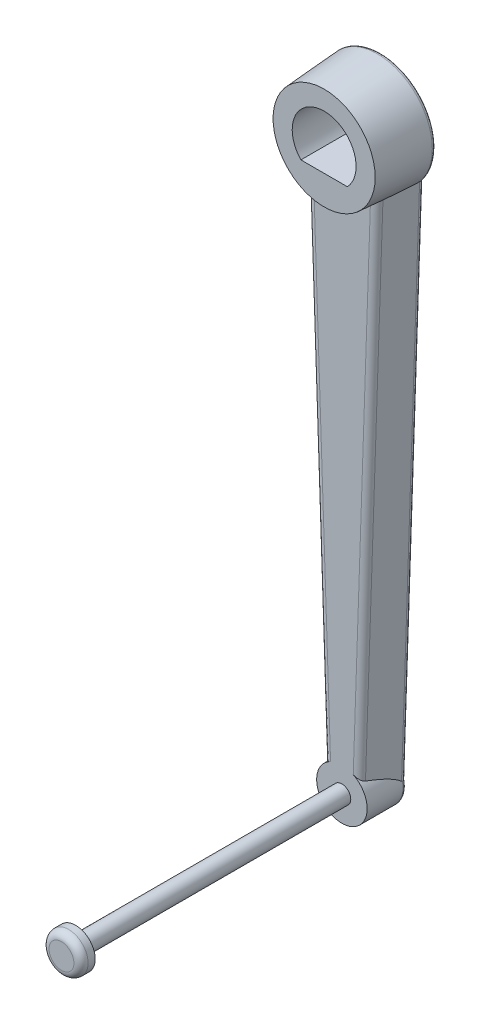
SolidWorks part; units mm, degrees
ref_plane "Plane1" through (0, 0, 0) normal (0, 0, 1) x (1, 0, 0)
ref_plane "Plane2" through (0, 0, 0) normal (0, 1, 0) x (1, 0, 0)
ref_plane "Plane3" through (0, 0, 0) normal (1, 0, 0) x (0, 0, -1)
sketch "Sketch1" plane through (0, 0, 0) normal (0, 0, 1) x (1, 0, 0)
  circle A0 centre (0, 0) radius 15.5
  dimension "D1" = 31
extrude "Base-Extrude" add sketch "Sketch1" along normal blind 16 draft 4
sketch "Sketch2" plane through (0, 0, 0) normal (0, 0, -1) x (-1, 0, 0)
  line L0 (0, 0) -> (0, -179.0103) construction
  line L1 (12.4083, -4.9633) -> (7.1192, -160)
  line L2 (-12.4083, -4.9633) -> (-7.1192, -160)
  line L3 (-7.1192, -160) -> (7.1192, -160)
  line L4 (-12.4083, -4.9633) -> (12.4083, -4.9633)
extrude "Boss-Extrude1" add sketch "Sketch2" against normal blind 11 draft 13
sketch "Sketch3" plane through (0, 0, 11) normal (0, 0, 1) x (1, 0, 0)
  line L0 (0, 0) -> (0, -165.9361) construction
  circle A0 centre (0, -160.1497) radius 7.1141
extrude "Boss-Extrude2" add sketch "Sketch3" against normal blind 11
sketch "Sketch4" plane through (0, 0, 11) normal (0, 0, 1) x (1, 0, 0)
  circle A0 centre (0, -160.1497) radius 2.5
  dimension "D1" = 5
extrude "Boss-Extrude3" add sketch "Sketch4" along normal blind 75
sketch "Sketch5" plane through (0, 0, 86) normal (0, 0, 1) x (1, 0, 0)
  circle A0 centre (0, -160.1497) radius 5.5
  dimension "D1" = 11
extrude "Boss-Extrude4" add sketch "Sketch5" along normal blind 4
fillet "Fillet1" radius 2
sketch "Sketch6" plane through (0, 0, 16) normal (0, 0, 1) x (1, 0, 0)
  line L0 (-6.5518, -6.1704) -> (6.5518, -6.1704)
  arc A0 (6.5518, -6.1704) -> (-6.5518, -6.1704) centre (0, 0) ccw
  dimension "D1" = 18
extrude "Cut-Extrude2" cut sketch "Sketch6" against normal through all
sketch "Sketch7" plane through (0, 0, 0) normal (0, 0, -1) x (-1, 0, 0)
  line L0 (-6.6236, -9.0555) -> (6.6236, -9.0555)
  line L1 (9.6218, -12.1578) -> (4.7866, -153.891)
  line L2 (1.7883, -156.7887) -> (-1.7883, -156.7887)
  line L3 (-4.7866, -153.891) -> (-9.6218, -12.1578)
  line L4 (12.2538, -9.4918) -> (7.1192, -160) construction
  line L5 (-12.2538, -9.4918) -> (-7.1192, -160) construction
  arc A0 (1.7883, -156.7887) -> (4.7866, -153.891) centre (1.7883, -153.7887) ccw
  arc A1 (-4.7866, -153.891) -> (-1.7883, -156.7887) centre (-1.7883, -153.7887) ccw
  arc A2 (9.6218, -12.1578) -> (6.6236, -9.0555) centre (6.6236, -12.0555) ccw
  arc A3 (-9.6218, -12.1578) -> (-6.6236, -9.0555) centre (-6.6236, -12.0555) cw
  dimension "D3" = 3
  dimension "D1" = 2.5396
  dimension "D2" = 2.5396
extrude "Cut-Extrude3" cut sketch "Sketch7" against normal blind 3
fillet "Fillet2" radius 2
fillet "Fillet3" radius 0.9
